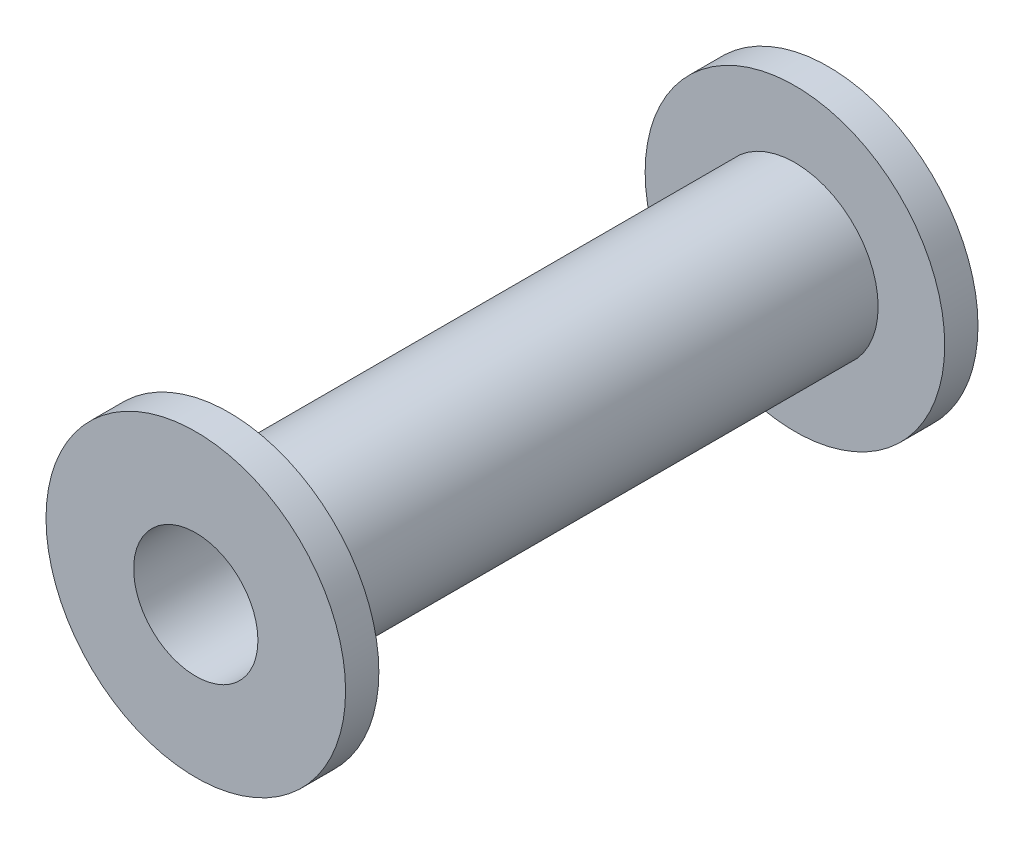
SolidWorks part; units mm, degrees
ref_plane "Plano frontal" through (0, 0, 0) normal (0, 0, 1) x (1, 0, 0)
ref_plane "Plano superior" through (0, 0, 0) normal (0, 1, 0) x (1, 0, 0)
ref_plane "Plano direito" through (0, 0, 0) normal (1, 0, 0) x (0, 0, -1)
sketch "Esboço1" plane through (0, 0, 0) normal (0, 0, 1) x (1, 0, 0)
  circle A0 centre (0, 0) radius 5.6
  circle A1 centre (0, 0) radius 13.5
  dimension "D1" = 11.2
  dimension "D2" = 27
extrude "Ressalto-extrusão1" add sketch "Esboço1" along normal blind 3
sketch "Esboço2" plane through (0, 0, 3) normal (0, 0, 1) x (1, 0, 0)
  circle A0 centre (0, 0) radius 7.5
  circle A1 centre (0, 0) radius 5.6
  circle A2 centre (0, 0) radius 5.6 construction
  dimension "D1" = 15
extrude "Ressalto-extrusão2" add sketch "Esboço2" along normal blind 51
sketch "Esboço3" plane through (0, 0, 54) normal (0, 0, 1) x (1, 0, 0)
  circle A0 centre (0, 0) radius 13.5
  circle A1 centre (0, 0) radius 5.6
  circle A2 centre (0, 0) radius 5.6 construction
  dimension "D2" = 27
extrude "Ressalto-extrusão3" add sketch "Esboço3" along normal blind 3
sketch "Esboço6" plane through (0, 0, 0) normal (0, 0, -1) x (-1, 0, 0)
  line L0 (0, 0) -> (0, 9) construction
  dimension "D1" = 9
